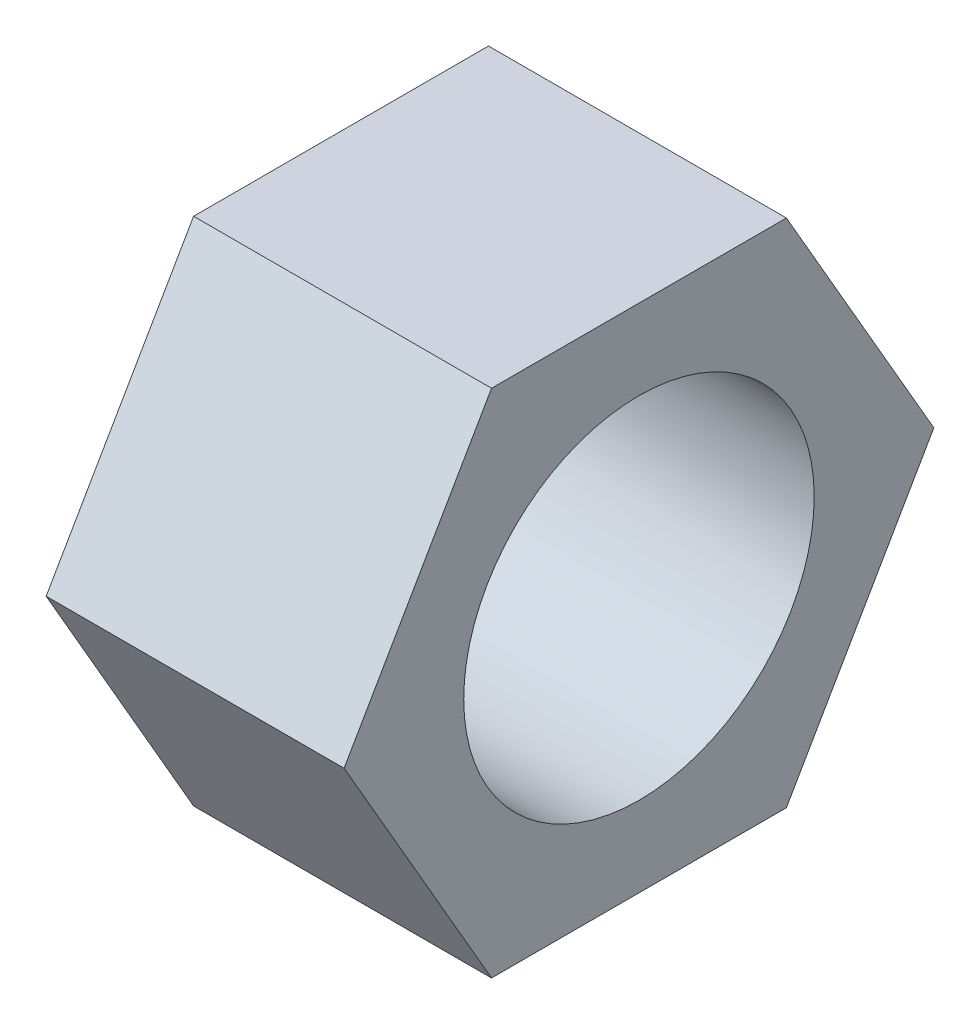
SolidWorks part; units mm, degrees
ref_plane "Front Plane" through (0, 0, 0) normal (0, 0, 1) x (1, 0, 0)
ref_plane "Top Plane" through (0, 0, 0) normal (0, 1, 0) x (1, 0, 0)
ref_plane "Right Plane" through (0, 0, 0) normal (1, 0, 0) x (0, 0, -1)
sketch "Sketch1" plane through (0, 0, 0) normal (1, 0, 0) x (0, 0, -1)
  line L1 (4.1244, 7.1438) -> (-4.1244, 7.1437)
  line L2 (-4.1244, 7.1437) -> (-8.2489, 0)
  line L3 (-8.2489, 0) -> (-4.1244, -7.1438)
  line L4 (-4.1244, -7.1438) -> (4.1244, -7.1437)
  line L5 (4.1244, -7.1437) -> (8.2489, 0)
  line L6 (8.2489, 0) -> (4.1244, 7.1438)
  circle A0 centre (0, 0) radius 7.1438 construction
  dimension "D1" = 14.2875
extrude "Boss-Extrude1" add sketch "Sketch1" along normal blind 8.3344
hole_wizard "3/8 Clearance Hole1" positions "Sketch3" profile "Sketch2" hole size "3/8" standard "ANSI Inch"
sketch "Sketch3" plane through (8.3344, 0, 0) normal (1, 0, 0) x (0, 0, -1)
  point P0 (0, 0)
sketch "Sketch2" plane through (8.3344, 0, 0) normal (0, 1, 0) x (0, 0, -1)
  line L0 (0, 0) -> (0, 8.3344)
  line L1 (0, 8.3344) -> (4.9022, 8.3344)
  line L2 (4.9022, 8.3344) -> (4.9022, 0)
  line L5 (4.9022, 0) -> (0, 0)
  line L11 (0, -6.35) -> (0, 107.95) construction
  dimension "Thru Hole Dia." = 9.8044
  dimension "Thru Hole Depth" = 8.3344
